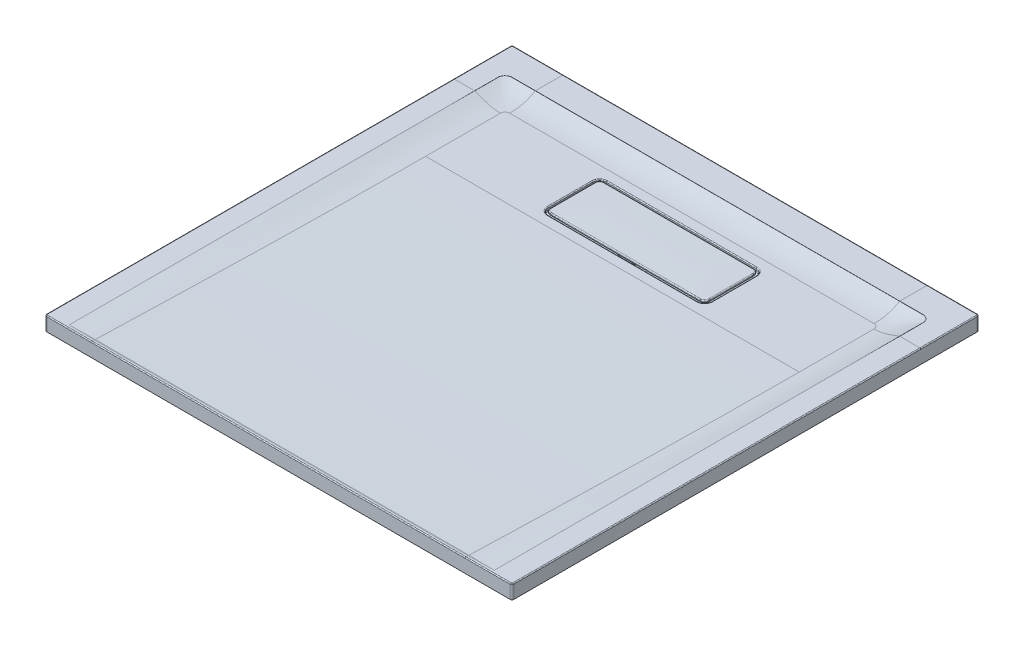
SolidWorks part; units mm, degrees
ref_plane "Płaszczyzna przednia" through (0, 0, 0) normal (0, 0, 1) x (1, 0, 0)
ref_plane "Płaszczyzna górna" through (0, 0, 0) normal (0, 1, 0) x (1, 0, 0)
ref_plane "Płaszczyzna prawa" through (0, 0, 0) normal (1, 0, 0) x (0, 0, -1)
sketch "Szkic1" plane through (0, 0, 0) normal (0, 1, 0) x (1, 0, 0)
  line L0 (0, 300) -> (0, 500) construction
  line L1 (-500, -500) -> (500, -500)
  line L2 (-500, -500) -> (-500, 500)
  line L3 (-500, 500) -> (500, 500)
  line L4 (500, -500) -> (500, 500)
  line L5 (-500, -500) -> (500, 500) construction
  line L6 (-500, 500) -> (500, -500) construction
  line L7 (-160, 237.5) -> (160, 237.5)
  line L8 (-175, 252.5) -> (-175, 347.5)
  line L9 (-160, 362.5) -> (160, 362.5)
  line L10 (175, 252.5) -> (175, 347.5)
  line L11 (-175, 237.5) -> (175, 362.5) construction
  line L12 (-175, 362.5) -> (175, 237.5) construction
  line L13 (-440, 440) -> (440, 440)
  line L14 (455, 425) -> (455, -493)
  line L15 (455, -493) -> (-455, -493)
  line L16 (-455, -493) -> (-455, 425)
  circle A6 centre (0, 300) radius 57.5
  circle A7 centre (0, 300) radius 45
  arc A8 (455, 425) -> (440, 440) centre (440, 425) ccw
  arc A9 (-455, 425) -> (-440, 440) centre (-440, 425) cw
  arc A10 (160, 362.5) -> (175, 347.5) centre (160, 347.5) cw
  arc A11 (175, 252.5) -> (160, 237.5) centre (160, 252.5) cw
  arc A12 (-160, 237.5) -> (-175, 252.5) centre (-160, 252.5) cw
  arc A13 (-175, 347.5) -> (-160, 362.5) centre (-160, 347.5) cw
  point P0 (0, 0)
  point P5 (0, 300)
  dimension "D10" = 115
  dimension "D11" = 90
  dimension "D12" = 15
  dimension "D13" = 15
  dimension "D1" = 1000
  dimension "D2" = 1000
  dimension "D3" = 200
  dimension "D4" = 125
  dimension "D5" = 350
  dimension "D6" = 60
  dimension "D7" = 45
  dimension "D8" = 45
  dimension "D9" = 7
ref_plane "Płaszczyzna1" through (0, -14, 0) normal (0, 1, 0) x (-1, 0, 0)
ref_plane "korek" through (0, -20.9, 0) normal (0, 1, 0) x (-1, 0, 0)
sketch "Szkic2" plane through (0, 0, 0) normal (0, 1, 0) x (1, 0, 0)
  line L0 (-500, 500) -> (500, 500) construction
  line L1 (-500, -500) -> (-500, 500) construction
  line L2 (-500, -500) -> (500, -500) construction
  line L3 (500, -500) -> (500, 500) construction
  line L5 (455, 425) -> (455, -493) construction
  line L6 (455, -493) -> (-455, -493) construction
  line L7 (-455, -493) -> (-455, 425) construction
  line L8 (-500, 500) -> (500, 500)
  line L9 (-500, -500) -> (-500, 500)
  line L10 (-500, -500) -> (500, -500)
  line L11 (500, -500) -> (500, 500)
  line L12 (-440, 440) -> (440, 440) construction
  line L13 (455, 425) -> (455, -493)
  line L14 (455, -493) -> (-455, -493)
  line L15 (-455, -493) -> (-455, 425)
  line L16 (-440, 440) -> (440, 440)
  arc A0 (455, 425) -> (440, 440) centre (440, 425) ccw construction
  arc A1 (-440, 440) -> (-455, 425) centre (-440, 425) ccw construction
  arc A2 (455, 425) -> (440, 440) centre (440, 425) ccw
  arc A3 (-440, 440) -> (-455, 425) centre (-440, 425) ccw
surface "Powierzchnia-Płaszczyzna1" sketch "Szkic2"
sketch "Szkic3" plane through (0, -14, 0) normal (0, 1, 0) x (-1, 0, 0)
  line L1 (440, -440) -> (-440, -440) construction
  line L2 (-455, -425) -> (-455, 493) construction
  line L3 (-455, 493) -> (455, 493) construction
  line L4 (-175, -252.5) -> (-175, -347.5) construction
  line L5 (160, -362.5) -> (-160, -362.5) construction
  line L6 (175, -252.5) -> (175, -347.5) construction
  line L7 (160, -237.5) -> (-160, -237.5) construction
  line L9 (-400, -215) -> (400, -215)
  line L10 (-400, -215) -> (-400, -375)
  line L11 (-390, -385) -> (390, -385)
  line L12 (400, -215) -> (400, -375)
  line L13 (-400, -215) -> (400, -385) construction
  line L14 (-400, -385) -> (400, -215) construction
  line L16 (455, 493) -> (455, -425) construction
  line L17 (440, -440) -> (-440, -440) construction
  line L18 (-175, -252.5) -> (-175, -347.5)
  line L19 (160, -362.5) -> (-160, -362.5)
  line L20 (175, -252.5) -> (175, -347.5)
  line L21 (160, -237.5) -> (-160, -237.5)
  line L22 (-455, -425) -> (-455, 493) construction
  line L23 (-455, 493) -> (455, 493) construction
  line L24 (455, 493) -> (455, -425) construction
  arc A0 (-175, -347.5) -> (-160, -362.5) centre (-160, -347.5) ccw construction
  arc A1 (160, -362.5) -> (175, -347.5) centre (160, -347.5) ccw construction
  arc A2 (175, -252.5) -> (160, -237.5) centre (160, -252.5) ccw construction
  arc A3 (-160, -237.5) -> (-175, -252.5) centre (-160, -252.5) ccw construction
  arc A4 (-175, -347.5) -> (-160, -362.5) centre (-160, -347.5) ccw
  arc A5 (160, -362.5) -> (175, -347.5) centre (160, -347.5) ccw
  arc A6 (175, -252.5) -> (160, -237.5) centre (160, -252.5) ccw
  arc A7 (-160, -237.5) -> (-175, -252.5) centre (-160, -252.5) ccw
  circle A8 centre (0, -300) radius 45 construction
  circle A9 centre (0, -300) radius 45
  arc A10 (-390, -385) -> (-400, -375) centre (-390, -375) cw
  arc A11 (-455, -425) -> (-440, -440) centre (-440, -425) ccw construction
  arc A12 (440, -440) -> (455, -425) centre (440, -425) ccw construction
  arc A13 (400, -375) -> (390, -385) centre (390, -375) cw
  arc A14 (-455, -425) -> (-440, -440) centre (-440, -425) ccw construction
  arc A15 (440, -440) -> (455, -425) centre (440, -425) ccw construction
  point P26 (0, 0)
  dimension "D3" = 10
  dimension "D4" = 10
  dimension "D1" = 55
  dimension "D2" = 55
surface "Powierzchnia-Płaszczyzna2" sketch "Szkic3"
sketch "Szkic4" plane through (0, 0, 0) normal (0, 1, 0) x (1, 0, 0)
  line L0 (-400, 215) -> (-400, -500)
  line L1 (-500, -500) -> (500, -500) construction
  line L2 (400, 215) -> (400, -500)
  line L3 (400, 215) -> (400, 375) construction
  line L4 (-390, 385) -> (-390, 775)
  line L5 (-400, 375) -> (-790, 375)
  line L6 (390, 385) -> (390, 775)
  line L7 (400, 375) -> (790, 375)
  line L8 (-790, 375) -> (-790, 775) construction
  line L9 (-790, 775) -> (-390, 775) construction
  line L10 (390, 775) -> (790, 775) construction
  line L11 (790, 775) -> (790, 375) construction
  arc A1 (-390, 385) -> (-400, 375) centre (-390, 375) ccw construction
  dimension "D1" = 400
  dimension "D2" = 400
  dimension "D3" = 400
  dimension "D4" = 400
other "Granica-Powierzchnia1"
surface "Powierzchnia-Wyciągnięcie po profilach3"
surface "Powierzchnia-Wyciągnięcie po profilach2"
mirror "Lustro2" about plane through (0, 0, 0) normal (1, 0, 0)
surface "Powierzchnia-Połącz1"
surface "Powierzchnia-Wyciągnięcie po profilach4"
sketch "Szkic5" plane through (0, 0, 0) normal (0, 1, 0) x (1, 0, 0)
  line L0 (-500, -500) -> (-500, 500) construction
  line L1 (-500, 500) -> (500, 500) construction
  line L2 (500, -500) -> (500, 500) construction
  line L3 (-500, -500) -> (500, -500) construction
  line L4 (-500, -500) -> (-500, 500)
  line L5 (-500, 500) -> (500, 500)
  line L6 (500, -500) -> (500, 500)
  line L7 (-500, -500) -> (500, -500)
mirror "Lustro4" about plane through (0, 0, 0) normal (1, 0, 0)
surface "Powierzchnia-Połącz3"
surface "Powierzchnia-Wyciągnięcie1" sketch "Szkic5" parameters "D1"=30
sketch "Szkic6" plane through (0, -14, 0) normal (0, 1, 0) x (-1, 0, 0)
  line L4 (-175, -252.5) -> (-175, -347.5) construction
  line L5 (160, -362.5) -> (-160, -362.5) construction
  line L6 (175, -252.5) -> (175, -347.5) construction
  line L7 (160, -237.5) -> (-160, -237.5) construction
  line L8 (-175, -252.5) -> (-175, -347.5)
  line L9 (160, -362.5) -> (-160, -362.5)
  line L10 (175, -252.5) -> (175, -347.5)
  line L11 (160, -237.5) -> (-160, -237.5)
  arc A0 (-175, -347.5) -> (-160, -362.5) centre (-160, -347.5) ccw construction
  arc A1 (160, -362.5) -> (175, -347.5) centre (160, -347.5) ccw construction
  arc A2 (175, -252.5) -> (160, -237.5) centre (160, -252.5) ccw construction
  arc A3 (-160, -237.5) -> (-175, -252.5) centre (-160, -252.5) ccw construction
  arc A4 (-175, -347.5) -> (-160, -362.5) centre (-160, -347.5) ccw
  arc A5 (160, -362.5) -> (175, -347.5) centre (160, -347.5) ccw
  arc A6 (175, -252.5) -> (160, -237.5) centre (160, -252.5) ccw
  arc A7 (-160, -237.5) -> (-175, -252.5) centre (-160, -252.5) ccw
surface "Powierzchnia-Wyciągnięcie2" sketch "Szkic6"
sketch "Szkic8" plane through (0, 0, 0) normal (1, 0, 0) x (0, 0, -1)
  line L0 (300, 0) -> (300, -30) construction
  line L1 (500, -30) -> (-500, -30) construction
  line L2 (345, -30) -> (345, -28)
  line L3 (345, -28) -> (357.615, -20.9)
  line L4 (300, -30) -> (345, -30) construction
  line L5 (357.615, -20.9) -> (550, -20.9)
  dimension "D1" = 45
  dimension "D2" = 2
  dimension "D3" = 115.23
  dimension "D4" = 20.9
  dimension "D5" = 250
surface "Powierzchnia-Obrót1" sketch "Szkic8" parameters "D1"=360
surface "Powierzchnia-Przytnij1"
surface "Powierzchnia-Płaszczyzna3"
surface "Powierzchnia-Połącz4"
fillet "Zaokrąglenie1" radius 4 4 edges at (-500, -15, 500) (-500, -15, -500) (500, -15, -500) (500, -15, 500)
fillet "Zaokrąglenie2" radius 2 22 edges at (-500, 0, -435.5) (-498.8284, 0, -498.8284) (-443, 0, -500) (0, 0, -500) (443, 0, -500) (498.8284, 0, -498.8284) (500, 0, -435.5) (500, 0, 60.5) (498.8284, 0, 498.8284) (448, 0, 500) (-448, 0, 500) (0, 0, 500) (-498.8284, 0, 498.8284) (-500, 0, 60.5) (-170.6066, -14, -358.1066) (-175, -14, -300) (-170.6066, -14, -241.8934) (0, -14, -237.5) (170.6066, -14, -241.8934) (175, -14, -300) (170.6066, -14, -358.1066) (0, -14, -362.5)
fillet "Zaokrąglenie3" radius 1 8 edges at (0, -20.9, -362.5) (170.6066, -20.9, -358.1066) (175, -20.9, -300) (170.6066, -20.9, -241.8934) (0, -20.9, -237.5) (-170.6066, -20.9, -241.8934) (-175, -20.9, -300) (-170.6066, -20.9, -358.1066)
fillet "Zaokrąglenie4" radius 1 9 edges
fillet "Zaokrąglenie5" radius 1 2 edges at (0, -28, -345) (0, -20.9, -357.615)
fillet "Zaokrąglenie6" radius 55 3 edges
ref_plane "Płaszczyzna2" through (0, -17, 0) normal (0, 1, 0) x (-1, 0, 0)
sketch "Szkic9" plane through (0, -17, 0) normal (0, 1, 0) x (-1, 0, 0)
  line L1 (-160, -242.5) -> (160, -242.5)
  line L2 (-170, -252.5) -> (-170, -347.5)
  line L3 (-160, -357.5) -> (160, -357.5)
  line L4 (170, -252.5) -> (170, -347.5)
  line L5 (-170, -242.5) -> (170, -357.5) construction
  line L6 (-170, -357.5) -> (170, -242.5) construction
  arc A0 (160, -242.5) -> (170, -252.5) centre (160, -252.5) cw
  arc A1 (170, -347.5) -> (160, -357.5) centre (160, -347.5) cw
  arc A2 (-160, -357.5) -> (-170, -347.5) centre (-160, -347.5) cw
  arc A3 (-170, -252.5) -> (-160, -242.5) centre (-160, -252.5) cw
  point P0 (0, -300)
  dimension "D3" = 10
  dimension "D1" = 340
  dimension "D2" = 115
extrude "Dodanie-wyciągnięcie1" add sketch "Szkic9" along normal blind 4 separate body
sketch "Szkic10" plane through (0, 0, 0) normal (1, 0, 0) x (0, 0, -1)
  line L0 (300, -13) -> (300, -12) construction
  line L1 (252.5, -13) -> (347.5, -13) construction
  arc A0 (300, -12) -> (242.5, -13) centre (300, -1665.625) ccw
  arc A1 (300, -12) -> (357.5, -13) centre (300, -1665.625) cw
  dimension "D1" = 1
ref_plane "Płaszczyzna3" through (0, 0, -300) normal (0, 0, -1) x (-1, 0, 0)
sketch "Szkic11" plane through (0, 0, -300) normal (0, 0, -1) x (-1, 0, 0)
  line L0 (0, -13) -> (0, -12) construction
  line L1 (-160, -13) -> (160, -13) construction
  arc A0 (0, -12) -> (-170, -13) centre (0, -14462.5) ccw
  arc A1 (0, -12) -> (170, -13) centre (0, -14462.5) cw
  dimension "D1" = 1
other "Usuń ścianę1"
surface "Powierzchnia-wypełnij1"
surface "Powierzchnia-Połącz5"
fillet "Zaokrąglenie7" radius 2 8 edges
